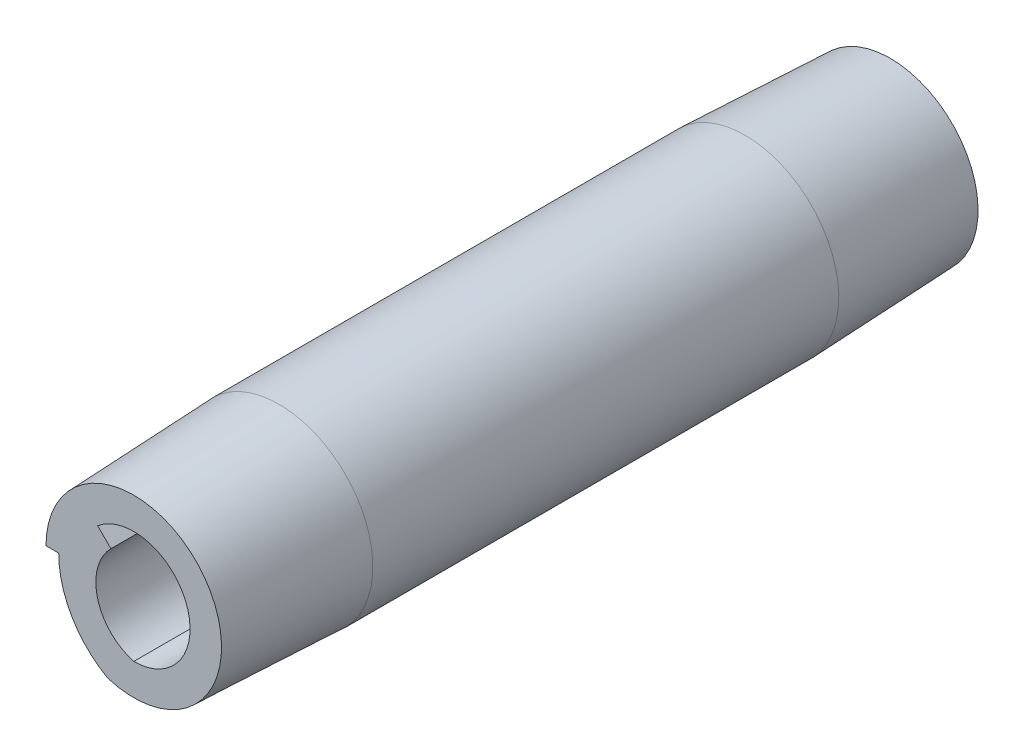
SolidWorks part; units mm, degrees
ref_plane "Plane1" through (0, 0, 0) normal (0, 0, 1) x (1, 0, 0)
ref_plane "Plane2" through (0, 0, 0) normal (0, 1, 0) x (1, 0, 0)
ref_plane "Plane3" through (0, 0, 0) normal (1, 0, 0) x (0, 0, -1)
sketch "Sketch1" plane through (0, 0, 0) normal (0, 0, 1) x (1, 0, 0)
  line L0 (0.4331, 0) -> (-0.4331, 0) construction
  line L1 (0, -0.4331) -> (0, 0.4331) construction
  line L2 (-0.3937, 0) -> (-0.315, 0)
  line L3 (-0.315, 0) -> (-0.2362, 0) construction
  line L4 (-0.1515, 0.1812) -> (-0.0958, 0.1255)
  line L5 (-0.2362, 0) -> (-0.1575, 0) construction
  arc A0 (-0.3937, 0) -> (0, -0.3937) centre (0, 0) cw
  arc A1 (-0.315, 0) -> (0, -0.315) centre (0, 0) cw construction
  arc A2 (0, -0.3937) -> (-0.315, 0) centre (0.0886, 0) cw
  arc A3 (-0.2362, 0) -> (-0.1515, 0.1812) centre (0, 0) cw construction
  arc A4 (0, -0.2362) -> (-0.0958, 0.1255) centre (0.0572, -0.0275) cw
  arc A5 (-0.1515, 0.1812) -> (0, -0.2362) centre (0, 0) cw
  circle A6 centre (0, 0) radius 0.3683 construction
extrude "Boss-Extrude1" add sketch "Sketch1" along normal mid plane 3.175
sketch "ChamferSke" plane through (0, 0, 0) normal (1, 0, 0) x (0, 0, -1)
  line L0 (-1.5875, 0.9784) -> (-1.5875, 0.3683)
  line L1 (-1.5875, 0.3683) -> (-0.9779, 0.3937)
  line L2 (-0.9779, 0.3937) -> (0.9779, 0.3937)
  line L3 (0.9779, 0.3937) -> (1.5875, 0.3683)
  line L4 (1.5875, 0.3683) -> (1.5875, 0.9784)
  line L5 (1.5875, 0.9784) -> (-1.5875, 0.9784)
  line L7 (0, 0) -> (-1.5875, 0) construction
revolve "Chamfer" cut sketch "ChamferSke" angle 360 about L7
equation "\"D1@Sketch1\"=\"Diameter@Sketch1\"/10"
equation "\"D1@ChamferSke\"=\"ChamferB@Sketch1\""
equation "\"D2@ChamferSke\"=\"Diameter@Sketch1\""
